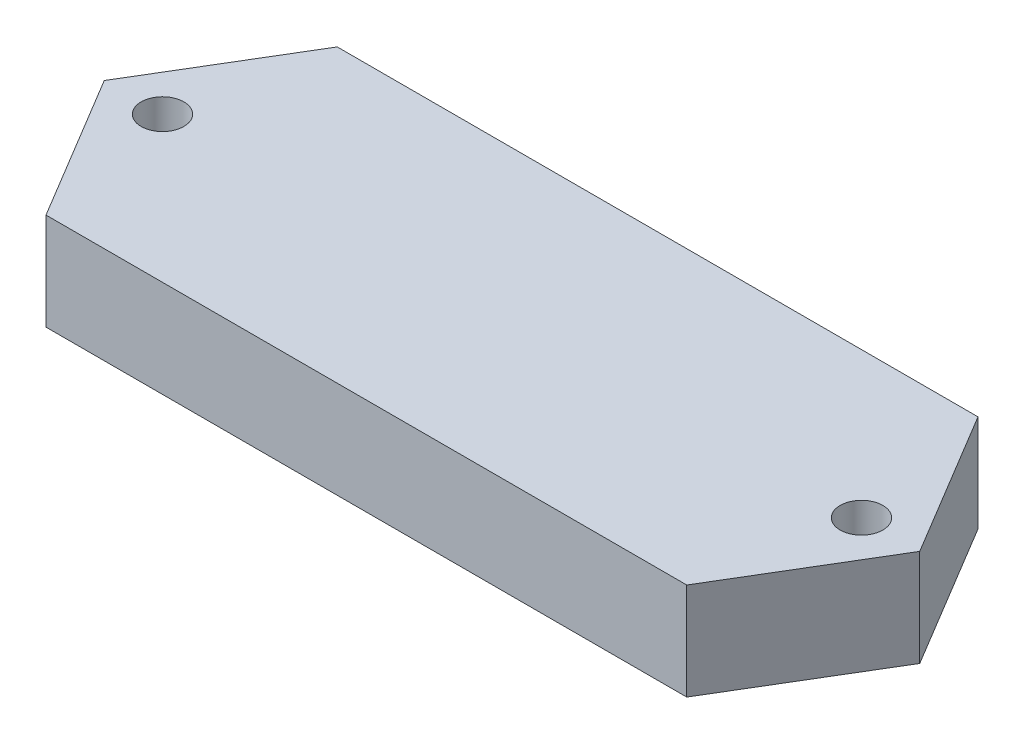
SolidWorks part; units mm, degrees
ref_plane "前视基准面" through (0, 0, 0) normal (0, 0, 1) x (1, 0, 0)
ref_plane "上视基准面" through (0, 0, 0) normal (0, 1, 0) x (1, 0, 0)
ref_plane "右视基准面" through (0, 0, 0) normal (1, 0, 0) x (0, 0, -1)
other "Configuration Table"
sketch "草图1" plane through (0, 0, 0) normal (0, 1, 0) x (1, 0, 0)
  line L0 (-16.5, -7.5) -> (-21, 0)
  line L1 (16.5, 7.5) -> (-16.5, 7.5)
  line L2 (16.5, 7.5) -> (16.5, -7.5)
  line L3 (16.5, -7.5) -> (-16.5, -7.5)
  line L4 (-16.5, 7.5) -> (-16.5, -7.5)
  line L5 (16.5, 7.5) -> (-16.5, -7.5) construction
  line L6 (16.5, -7.5) -> (-16.5, 7.5) construction
  line L7 (-21, 0) -> (-16.5, 7.5)
  line L8 (-16.5, 0) -> (16.5, 0) construction
  line L9 (0, 7.5) -> (0, -7.5) construction
  line L10 (21, 0) -> (16.5, 7.5)
  line L11 (16.5, -7.5) -> (21, 0)
  circle A0 centre (-18, 0) radius 1.1
  circle A1 centre (18, 0) radius 1.1
  point P0 (0, 0)
  dimension "D4" = 2.2
  dimension "D1" = 33
  dimension "D2" = 15
  dimension "D3" = 21
  dimension "D5" = 36
extrude "凸台-拉伸1" add sketch "草图1" along normal blind 5 contours L1 L4 L3 L2 | L7 L0 L4 A0 | L2 L11 L10 A1
